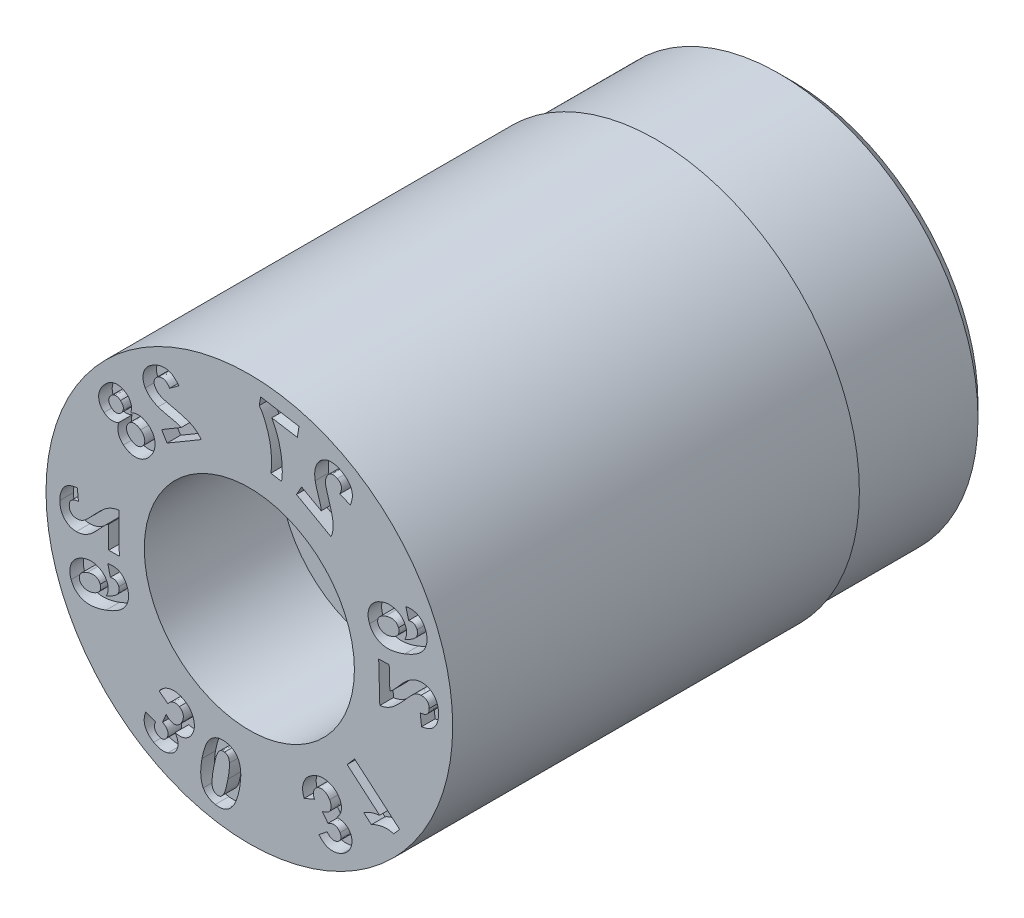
SolidWorks part; units mm, degrees
ref_plane "Front Plane" through (0, 0, 0) normal (0, 0, 1) x (1, 0, 0)
ref_plane "Top Plane" through (0, 0, 0) normal (0, 1, 0) x (1, 0, 0)
ref_plane "Right Plane" through (0, 0, 0) normal (1, 0, 0) x (0, 0, -1)
sketch "Sketch1" plane through (0, 0, 0) normal (1, 0, 0) x (0, 0, -1)
  line L2 (0, 3) -> (0, 1.55)
  line L3 (7.75, 3) -> (0, 3)
  line L4 (-3.7979, 0) -> (49996.2021, 0) construction
  line L8 (8, 0.8) -> (2, 0.8)
  line L9 (2, 1.55) -> (2, 0.8)
  line L10 (2, 1.55) -> (0, 1.55)
  line L12 (8, 0.8) -> (8, 2.75)
  line L16 (8, 2.75) -> (7.75, 3)
  dimension "D1" = 8
  dimension "D2" = 45
  dimension "D3" = 0.25
  dimension "D4" = 6
  dimension "D5" = 3.1
  dimension "D6" = 2
  dimension "D7" = 1.6
revolve "Revolve1" add sketch "Sketch1" angle 360 about L4
sketch "Sketch4" plane through (0, 0, 0) normal (1, 0, 0) x (0, 0, -1)
  line L0 (0, 0) -> (50000, 0) construction
  line L1 (8, -2.75) -> (8, 2.75) construction
  line L2 (6, 3.935) -> (8, 3.935)
  line L3 (6, 3.935) -> (6, 2.935)
  line L4 (6, 2.935) -> (8, 2.935)
  line L5 (8, 3.935) -> (8, 2.935)
  line L6 (7.75, 3) -> (0, 3) construction
  line L9 (0, 3.3) -> (0, -3.3) construction
  dimension "D1" = 1
  dimension "D2" = 0.065
  dimension "D3" = 6
revolve "Cut-Revolve1" cut sketch "Sketch4" angle 360 about L0
sketch "Sketch6" plane through (0, 0, 0) normal (0, 0, 1) x (1, 0, 0)
  arc A0 (1.9256, -0.3008) -> (1.834, -0.6594) centre (0, 0) ccw construction
  text T0 "26  27  28  29  30  31" font "Arial" height 0.88
extrude "Cut-Extrude1" cut sketch "Sketch6" against normal blind 0.2
